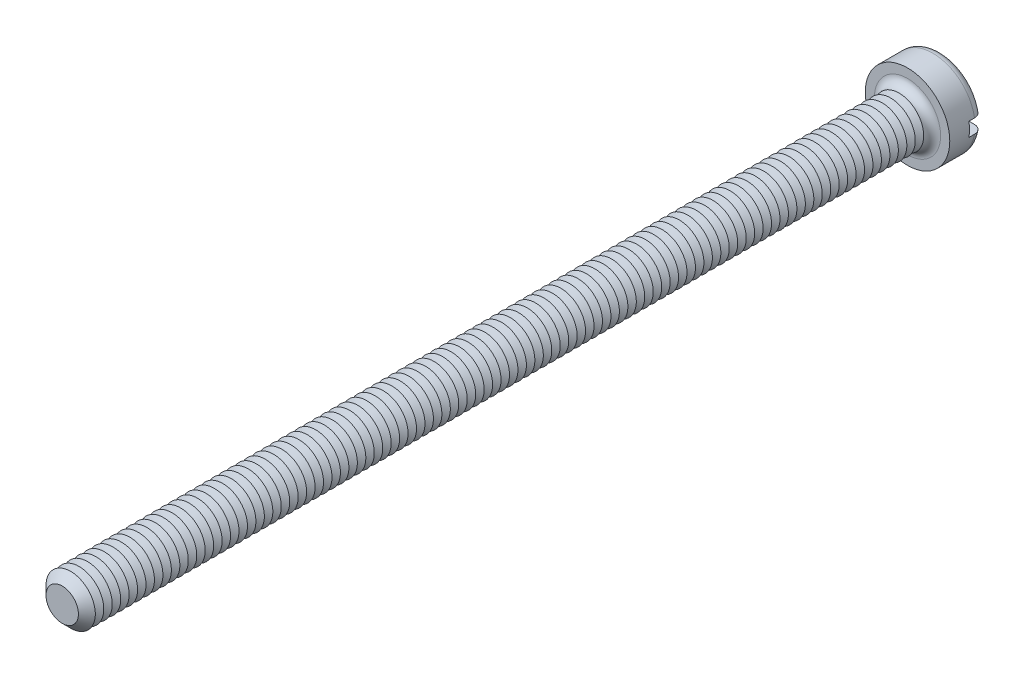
SolidWorks part; units mm, degrees
ref_plane "Front Plane" through (0, 0, 0) normal (0, 0, 1) x (1, 0, 0)
ref_plane "Top Plane" through (0, 0, 0) normal (0, 1, 0) x (1, 0, 0)
ref_plane "Right Plane" through (0, 0, 0) normal (1, 0, 0) x (0, 0, -1)
sketch "Sketch3" plane through (0, 0, 0) normal (0, 0, 1) x (1, 0, 0)
  circle A0 centre (0, 0) radius 3
  dimension "D1" = 6
extrude "Boss-Extrude2" add sketch "Sketch3" against normal blind 2.4
sketch "Sketch4" plane through (0, 0, 0) normal (0, 0, 1) x (1, 0, 0)
  circle A0 centre (0, 0) radius 1.75
  dimension "D1" = 3.5
extrude "Boss-Extrude3" add sketch "Sketch4" along normal blind 60
fillet "Fillet1" radius 0.6 2 edges at (3, 0, -2.4) (1.75, 0, 0)
chamfer "Chamfer1" distance 0.6 angle 45 1 edges at (1.75, 0, 60)
sketch "Sketch5" plane through (0, 0, 0) normal (1, 0, 0) x (0, 0, -1)
  line L0 (1.6944, 0) -> (-7.6738, 0) construction
sketch "Sketch6" plane through (0, 0, 0) normal (1, 0, 0) x (0, 0, -1)
  line L0 (-0.6, 1.75) -> (-0.9, 1.2304)
  line L1 (-0.9, 1.2304) -> (-1.2, 1.75)
  line L2 (-0.6, 1.75) -> (-59.4, 1.75) construction
  line L3 (-1.2, 1.75) -> (-0.6, 1.75)
  dimension "D1" = 0.6
revolve "Cut-Revolve1" cut sketch "Sketch6" angle 360 about L0
pattern_linear "LPattern1" count 98 spacing 0.6 along (0, 0, 1) of "Cut-Revolve1"
sketch "Sketch8" plane through (0, 0, -2.4) normal (0, 0, -1) x (-1, 0, 0)
  line L1 (3, -0.5) -> (-3, -0.5)
  line L2 (3, -0.5) -> (3, 0.5)
  line L3 (3, 0.5) -> (-3, 0.5)
  line L4 (-3, -0.5) -> (-3, 0.5)
  line L5 (3, -0.5) -> (-3, 0.5) construction
  line L6 (3, 0.5) -> (-3, -0.5) construction
  point P0 (0, 0)
  dimension "D1" = 6
  dimension "D2" = 1
extrude "Cut-Extrude1" cut sketch "Sketch8" against normal blind 1
